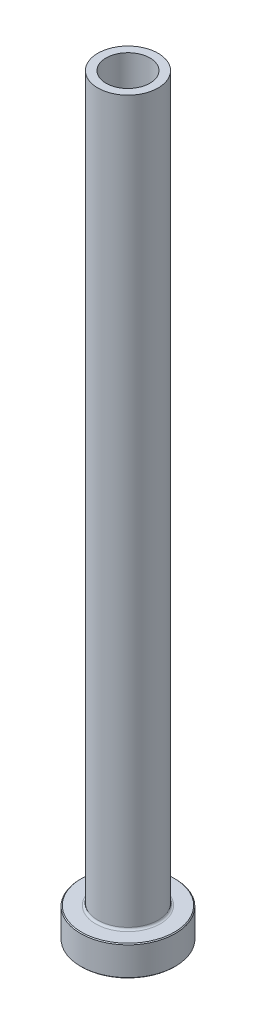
SolidWorks part; units mm, degrees
ref_plane "Front Plane" through (0, 0, 0) normal (0, 0, 1) x (1, 0, 0)
ref_plane "Top Plane" through (0, 0, 0) normal (0, 1, 0) x (1, 0, 0)
ref_plane "Right Plane" through (0, 0, 0) normal (1, 0, 0) x (0, 0, -1)
sketch "Sketch1" plane through (0, 0, 0) normal (0, 0, 1) x (1, 0, 0)
  line L0 (-5.1, 175) -> (-7, 175)
  line L1 (-7, 175) -> (-7, 7)
  line L2 (-7, 7) -> (-11, 7)
  line L3 (-11, 7) -> (-11, 0)
  line L4 (12.1, 0) -> (-12.1, 0) construction
  line L5 (-11, 0) -> (-5.35, 0)
  line L6 (-5.1, 120) -> (-5.1, 175)
  line L7 (0, 92.1877) -> (0, -15.5353) construction
  line L8 (0, -12.1) -> (0, 12.1) construction
  line L9 (-5.1, 120) -> (-5.35, 108)
  line L10 (-5.35, 108) -> (-5.35, 0)
  dimension "D1" = 0.25
  dimension "ID" = 10.2
  dimension "OD" = 14
  dimension "L" = 175
  dimension "H" = 22
  dimension "T" = 7
  dimension "N" = 55
  dimension "D2" = 12
revolve "Revolve1" add sketch "Sketch1" angle 360 about L7
fillet "Fillet1" radius 0.5 1 edges at (0, 7, 7)
chamfer "Chamfer1" distance 0.2 angle 45 2 edges at (0, 7, 11) (0, 0, 11)
chamfer "Chamfer3" distance 0.5 angle 45 1 edges at (0, 0, 5.35)
